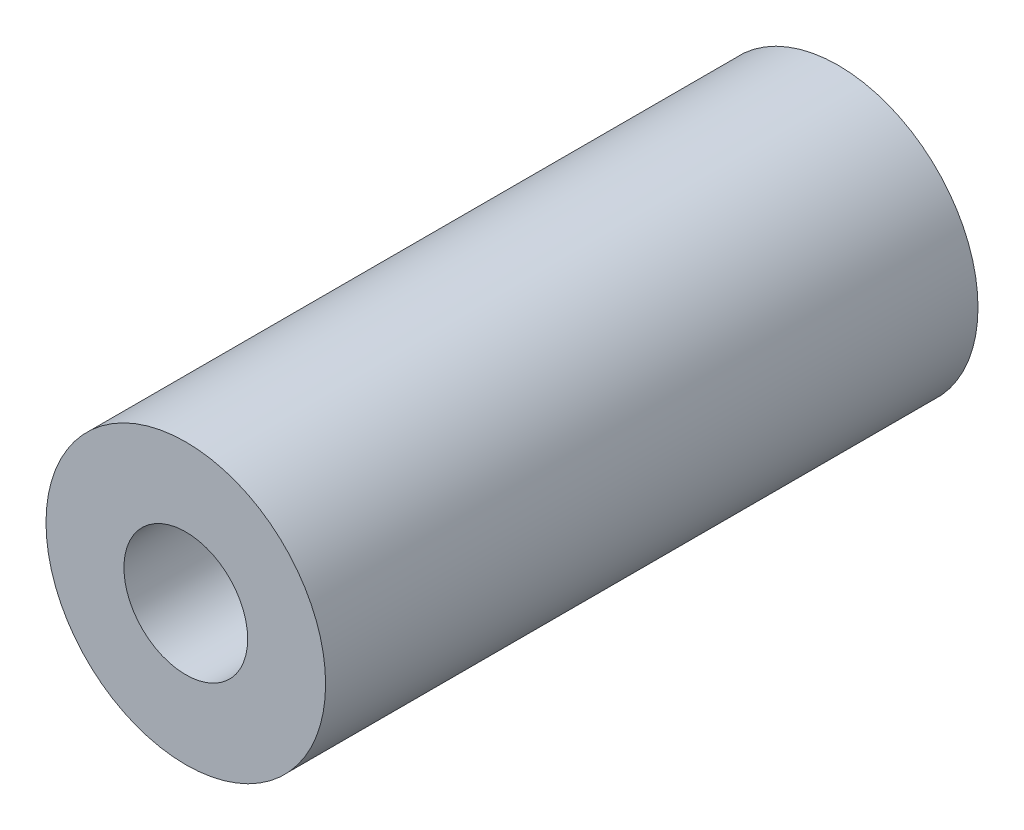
SolidWorks part; units mm, degrees
ref_plane "Front Plane" through (0, 0, 0) normal (0, 0, 1) x (1, 0, 0)
ref_plane "Top Plane" through (0, 0, 0) normal (0, 1, 0) x (1, 0, 0)
ref_plane "Right Plane" through (0, 0, 0) normal (1, 0, 0) x (0, 0, -1)
sketch "Sketch1" plane through (0, 0, 0) normal (0, 0, 1) x (1, 0, 0)
  line L0 (0, 2.1082) -> (0, 4.7625) construction
  line L1 (0, -2.1082) -> (0, -4.7625) construction
  circle A0 centre (0, 0) radius 4.7625
  circle A1 centre (0, 0) radius 2.1082
  dimension "OD" = 9.525
  dimension "ID" = 4.2164
sketch "Sketch2" plane through (0, 0, 0) normal (1, 0, 0) x (0, 0, -1)
  line L0 (-11.1125, 2.1082) -> (11.1125, 2.1082) construction
  line L1 (-11.1125, -2.1082) -> (11.1125, -2.1082) construction
  line L2 (-11.1125, -4.7625) -> (11.1125, -4.7625) construction
  line L3 (-11.1125, 4.7625) -> (11.1125, 4.7625) construction
  dimension "Length" = 22.225
extrude "Extrude1" add sketch "Sketch1" along normal up to vertex (11.1125 mm away) and the other way up to vertex (11.1125 mm away)
sketch "Sketch3" plane through (0, 0, 11.1125) normal (0, 0, 1) x (1, 0, 0)
  circle A0 centre (0, 0) radius 2.1082 construction
  circle A3 centre (0, 0) radius 2.1082
  point P3 (-2.1082, 0)
